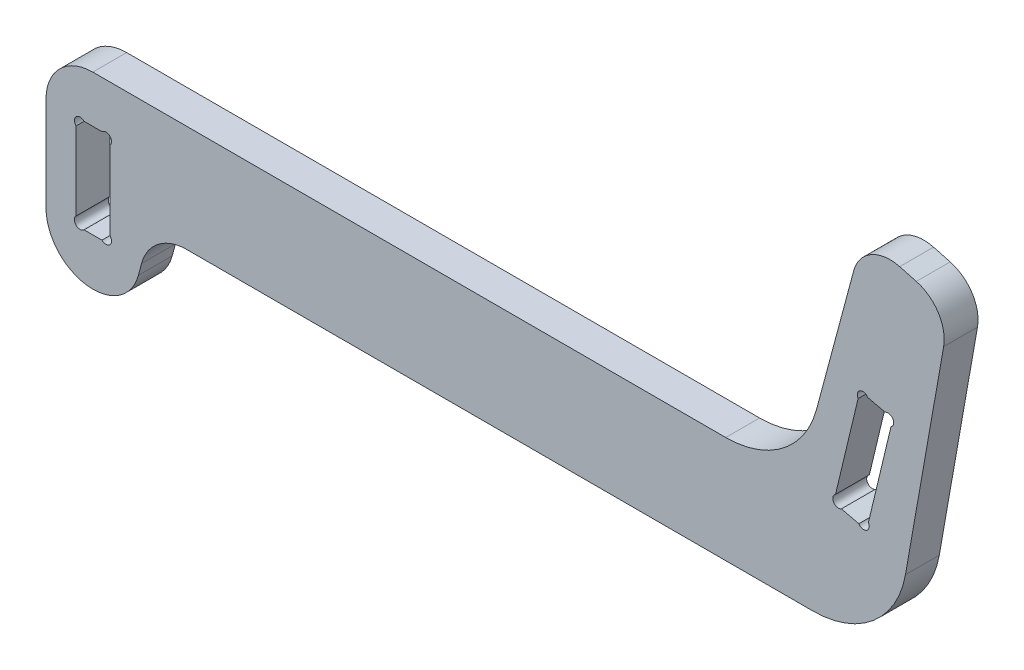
SolidWorks part; units mm, degrees
ref_plane "Plan de face" through (0, 0, 0) normal (0, 0, 1) x (1, 0, 0)
ref_plane "Plan de dessus" through (0, 0, 0) normal (0, 1, 0) x (1, 0, 0)
ref_plane "Plan de droite" through (0, 0, 0) normal (1, 0, 0) x (0, 0, -1)
sketch "Esquisse1" plane through (0, 0, 0) normal (0, 0, 1) x (1, 0, 0)
  line L0 (74.9, -6.7542) -> (407.9943, -6.7542)
  line L1 (457.2347, 34.5634) -> (477.5594, 149.8303)
  line L2 (0, 0) -> (0, 25.1)
  line L3 (24.9, 50) -> (361.6337, 50)
  line L4 (409.9299, 87.059) -> (429.7019, 160.8491)
  line L6 (0, 0) -> (0, -25.1)
  line L7 (24.9, -50) -> (25.1, -50)
  line L9 (434.8783, 180.1676) -> (480.7418, 167.8785) construction
  line L10 (412.1799, 95.4559) -> (465.4546, 81.181) construction
  line L11 (457.81, 174.023) -> (408.1364, -33.3895) construction
  line L12 (433.0264, 107.2408) -> (435.0894, 106.7468)
  line L13 (419.052, 48.8909) -> (436.557, 44.6986)
  line L14 (433.0264, 107.2408) -> (419.052, 48.8909)
  line L15 (450.5314, 103.0485) -> (436.557, 44.6986)
  line L16 (434.5953, 104.6838) -> (432.5323, 105.1779) construction
  line L17 (432.5323, 105.1779) -> (434.5953, 104.6838) construction
  line L18 (434.5953, 104.6838) -> (435.0894, 106.7468) construction
  line L19 (437.1523, 106.2527) -> (450.5314, 103.0485)
  line L20 (435.0894, 106.7468) -> (437.1523, 106.2527)
  line L21 (49.1521, -31.5426) -> (50.8479, -25.2116)
  line L22 (454.1968, 174.9912) -> (463.0396, 172.6218)
  arc A1 (457.2347, 34.5634) -> (407.9943, -6.7542) centre (407.9943, 43.2458) cw
  arc A2 (409.9299, 87.059) -> (361.6337, 50) centre (361.6337, 100) cw
  arc A3 (74.9, -6.7542) -> (50.8479, -25.2116) centre (74.9, -31.6542) ccw
  arc A4 (25.1, -50) -> (49.1521, -31.5426) centre (25.1, -25.1) ccw
  arc A5 (24.9, -50) -> (0, -25.1) centre (24.9, -25.1) cw
  arc A6 (0, 25.1) -> (24.9, 50) centre (24.9, 25.1) cw
  arc A7 (463.0396, 172.6218) -> (477.5594, 149.8303) centre (457.8632, 153.3033) cw
  arc A8 (454.1968, 174.9912) -> (429.7019, 160.8491) centre (449.0204, 155.6727) ccw
  point P10 (449.9493, -6.7542)
  point P13 (400, 50)
  point P21 (50, -50)
  point P24 (0, -50)
  point P27 (0, 50)
  point P37 (441.3224, 105.1788)
  dimension "D3" = 20
  dimension "D6" = 50
  dimension "D9" = 24.9
  dimension "D12" = 113.995
  dimension "D14" = 105
  dimension "D1" = 100
  dimension "D2" = 450
  dimension "D4" = 50
  dimension "D5" = 400
  dimension "D7" = 50
  dimension "D8" = 50
  dimension "D10" = 60
  dimension "D11" = 18
  dimension "D13" = 186.9218
extrude "Boss.-Extru.1" add sketch "Esquisse1" along normal blind 18
sketch "Esquisse2" plane through (0, 0, 18) normal (0, 0, 1) x (1, 0, 0)
  line L0 (25.1, -50) -> (24.9, 50) construction
  line L1 (361.6337, 50) -> (24.9, 50) construction
  line L2 (34, -25) -> (16, -25)
  line L3 (34, -25) -> (34, 25)
  line L4 (34, 25) -> (16, 25)
  line L5 (16, -25) -> (16, 25)
  line L6 (34, -25) -> (16, 25) construction
  line L7 (34, 25) -> (16, -25) construction
  point P4 (25, 0)
  dimension "D1" = 18
  dimension "D2" = 50
extrude "Enlèv. mat.-Extru.1" cut sketch "Esquisse2" against normal through all
sketch "Esquisse3" plane through (0, 0, 18) normal (0, 0, 1) x (1, 0, 0)
  line L0 (18.1213, 22.8787) -> (16, 22.8787) construction
  line L1 (16, 25) -> (16, -25) construction
  line L2 (18.1213, 22.8787) -> (18.1213, 25) construction
  line L3 (34, 25) -> (16, 25) construction
  line L4 (25, 25) -> (25, -25) construction
  line L5 (16, -25) -> (34, -25) construction
  line L6 (34, 0) -> (16, 0) construction
  line L7 (34, -25) -> (34, 25) construction
  circle A0 centre (18.1213, 22.8787) radius 3
  circle A1 centre (31.8787, -22.8787) radius 3
  circle A2 centre (31.8787, 22.8787) radius 3
  circle A3 centre (18.1213, -22.8787) radius 3
  point P17 (25, 0)
  point P22 (25, 0)
  dimension "D1" = 6
  dimension "D2" = 2
extrude "Enlèv. mat.-Extru.2" cut sketch "Esquisse3" against normal through all
sketch "Esquisse4" plane through (0, 0, 18) normal (0, 0, 1) x (1, 0, 0)
  line L0 (441.7789, 105.1447) -> (427.8045, 46.7947) construction
  line L1 (450.5314, 103.0485) -> (433.0264, 107.2408) construction
  line L2 (419.052, 48.8909) -> (436.557, 44.6986) construction
  line L3 (426.0392, 78.0659) -> (443.5442, 73.8736) construction
  line L4 (433.0264, 107.2408) -> (419.052, 48.8909) construction
  line L5 (436.557, 44.6986) -> (450.5314, 103.0485) construction
  line L6 (434.5953, 104.6838) -> (432.5323, 105.1779) construction
  line L7 (434.5953, 104.6838) -> (435.0894, 106.7468) construction
  circle A0 centre (434.5953, 104.6838) radius 3
  circle A1 centre (434.9881, 47.2556) radius 3
  circle A2 centre (447.9743, 101.4796) radius 3
  circle A3 centre (421.6091, 50.4598) radius 3
  point P12 (434.7917, 75.9697)
  point P22 (434.7917, 75.9697)
  dimension "D1" = 6
  dimension "D2" = 2
extrude "Enlèv. mat.-Extru.3" cut sketch "Esquisse4" against normal through all
